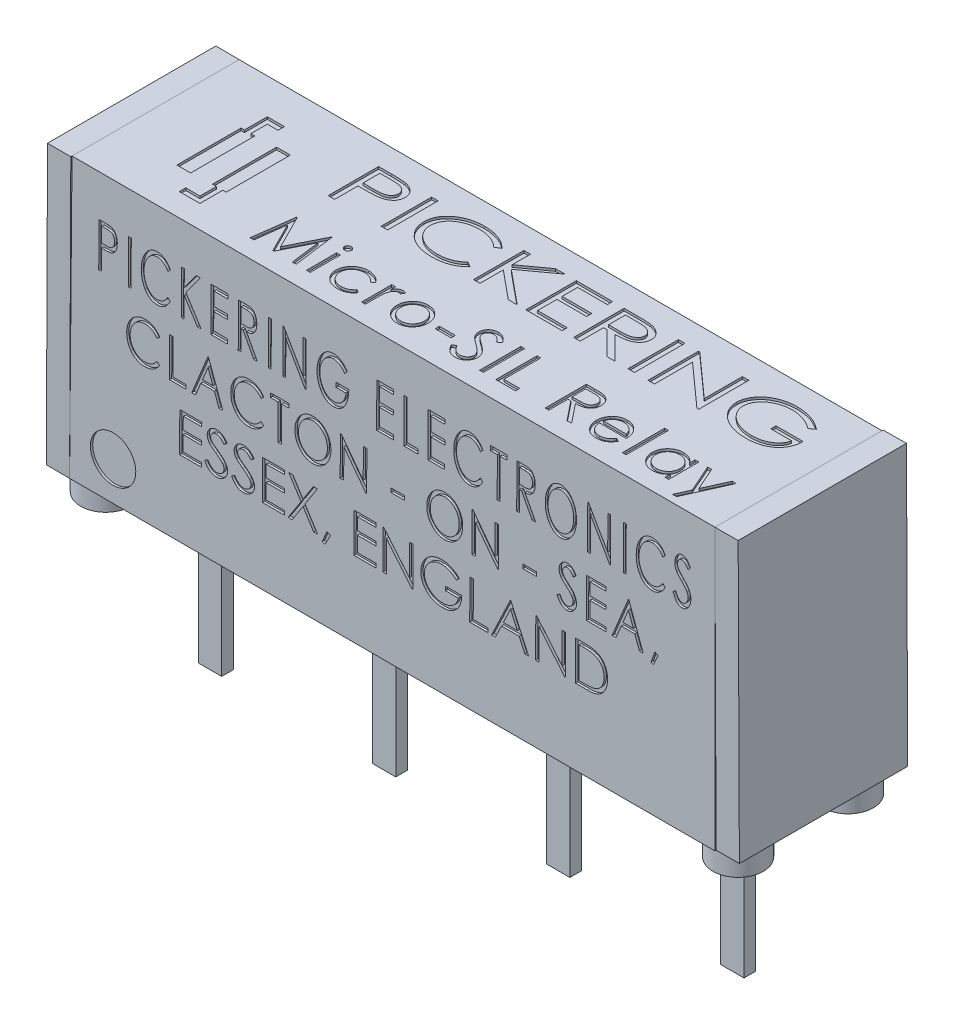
SolidWorks part; units mm, degrees
ref_plane "Front Plane" through (0, 0, 0) normal (0, 0, 1) x (1, 0, 0)
ref_plane "Top Plane" through (0, 0, 0) normal (0, 1, 0) x (1, 0, 0)
ref_plane "Right Plane" through (0, 0, 0) normal (1, 0, 0) x (0, 0, -1)
sketch "Sketch1" plane through (0, 0, 0) normal (0, 1, 0) x (1, 0, 0)
  line L1 (7.042, -1.85) -> (-7.042, -1.85)
  line L2 (7.042, -1.85) -> (7.042, 1.85)
  line L3 (7.042, 1.85) -> (-7.042, 1.85)
  line L4 (-7.042, -1.85) -> (-7.042, 1.85)
  line L5 (7.042, -1.85) -> (-7.042, 1.85) construction
  line L6 (7.042, 1.85) -> (-7.042, -1.85) construction
  point P0 (0, 0)
  dimension "D1" = 3.7
  dimension "D2" = 14.084
extrude "Main body" add sketch "Sketch1" along normal blind 6.092 draft 0.25
sketch "Sketch2" plane through (-7.0419, 0.0307, 0) normal (-1, 0.0044, 0) x (0, 0, 1)
  line L1 (-1.8234, 6.0613) -> (1.85, 6.0613)
  line L2 (-1.8234, 6.0613) -> (-1.8234, -0.0307)
  line L3 (-1.8234, -0.0307) -> (1.85, -0.0307)
  line L4 (1.85, 6.0613) -> (1.85, -0.0307)
  dimension "D1" = 6.092
extrude "side 1" add sketch "Sketch2" along normal blind 0.508 separate body
sketch "Sketch3" plane through (7.0419, 0.0307, 0) normal (1, 0.0044, 0) x (0, 0, -1)
  line L0 (-1.85, -0.0307) -> (1.85, -0.0307) construction
  line L1 (-1.8234, 6.0613) -> (1.85, 6.0613)
  line L2 (-1.8234, 6.0613) -> (-1.8234, -0.0307)
  line L3 (-1.8234, -0.0307) -> (1.85, -0.0307)
  line L4 (1.85, 6.0613) -> (1.85, -0.0307)
extrude "side 2" add sketch "Sketch3" along normal blind 0.508 separate body
sketch "Sketch4" plane through (0, 0, 0) normal (0, -1, 0) x (1, 0, 0)
  line L3 (-7.042, 1.85) -> (7.042, 1.85) construction
  line L4 (-7.55, -1.8234) -> (-7.55, 1.85) construction
  line L5 (7.042, -1.85) -> (-7.042, -1.85) construction
  line L6 (7.55, 1.8234) -> (7.55, -1.85) construction
  circle A0 centre (-6.9, 1.2) radius 0.55
  circle A1 centre (-6.9, -1.2) radius 0.55
  circle A2 centre (6.9, 1.2) radius 0.55
  circle A3 centre (6.9, -1.2) radius 0.55
  dimension "D1" = 1.1
  dimension "D2" = 0.65
  dimension "D3" = 0.65
  dimension "D4" = 1.1
  dimension "D5" = 0.65
  dimension "D6" = 0.65
  dimension "D7" = 1.1
  dimension "D8" = 0.65
  dimension "D9" = 1.1
extrude "Feet" add sketch "Sketch4" along normal blind 0.508 separate body
sketch "Sketch5" plane through (0, 0, 0) normal (0, -1, 0) x (1, 0, 0)
  line L0 (7.55, 1.8234) -> (7.55, -1.85) construction
  line L1 (-5.446, -0.127) -> (-5.954, -0.127)
  line L2 (-5.446, -0.127) -> (-5.446, 0.127)
  line L3 (-5.446, 0.127) -> (-5.954, 0.127)
  line L4 (-5.954, -0.127) -> (-5.954, 0.127)
  line L5 (-5.446, -0.127) -> (-5.954, 0.127) construction
  line L6 (-5.446, 0.127) -> (-5.954, -0.127) construction
  line L7 (-1.646, -0.127) -> (-2.154, -0.127)
  line L8 (-1.646, -0.127) -> (-1.646, 0.127)
  line L9 (-1.646, 0.127) -> (-2.154, 0.127)
  line L10 (-2.154, -0.127) -> (-2.154, 0.127)
  line L11 (-1.646, -0.127) -> (-2.154, 0.127) construction
  line L12 (-1.646, 0.127) -> (-2.154, -0.127) construction
  line L13 (1.646, -0.127) -> (2.154, -0.127)
  line L14 (1.646, -0.127) -> (1.646, 0.127)
  line L15 (1.646, 0.127) -> (2.154, 0.127)
  line L16 (2.154, -0.127) -> (2.154, 0.127)
  line L17 (1.646, -0.127) -> (2.154, 0.127) construction
  line L18 (1.646, 0.127) -> (2.154, -0.127) construction
  line L19 (5.954, -0.127) -> (5.446, -0.127)
  line L20 (5.954, -0.127) -> (5.954, 0.127)
  line L21 (5.954, 0.127) -> (5.446, 0.127)
  line L22 (5.446, -0.127) -> (5.446, 0.127)
  line L23 (5.954, -0.127) -> (5.446, 0.127) construction
  line L24 (5.954, 0.127) -> (5.446, -0.127) construction
  point P0 (-5.7, 0)
  point P5 (-1.9, 0)
  point P10 (1.9, 0)
  point P16 (5.7, 0)
  dimension "D1" = 0.508
  dimension "D2" = 0.254
  dimension "D3" = 0.508
  dimension "D4" = 0.254
  dimension "D5" = 0.254
  dimension "D6" = 0.254
  dimension "D7" = 0.508
  dimension "D8" = 0.508
  dimension "D9" = 3.8
  dimension "D10" = 3.8
  dimension "D11" = 3.8
  dimension "D12" = 1.85
extrude "Pins" add sketch "Sketch5" along normal blind 3.808
sketch "Sketch7"
  dimension "D1" = 10.4
  dimension "D2" = 0.4
  dimension "D3" = 1.6
  dimension "D4" = 0.4
  dimension "D5" = 1
  dimension "D6" = 1.4
  dimension "D7" = 0.3
  dimension "D8" = 0.45
  dimension "D9" = 0.3
  dimension "D10" = 1.4
  dimension "D11" = 0.14
  dimension "D12" = 0.14
  dimension "D13" = 0.14
  dimension "D14" = 0.14
  dimension "D15" = 0.5
  dimension "D16" = 0.5
extrude "top face writing" cut sketch "Sketch7" against normal blind 0.05
sketch "Sketch8"
  dimension "D1" = 1.85
  dimension "D2" = 13.2
  dimension "D3" = 0.442
  dimension "D4" = 1.3
  dimension "D5" = 1.3
extrude "Address" cut sketch "Sketch8" against normal blind 0.05
sketch "Sketch9"
extrude "Relay type" add sketch "Sketch9" along normal blind 0.0001
